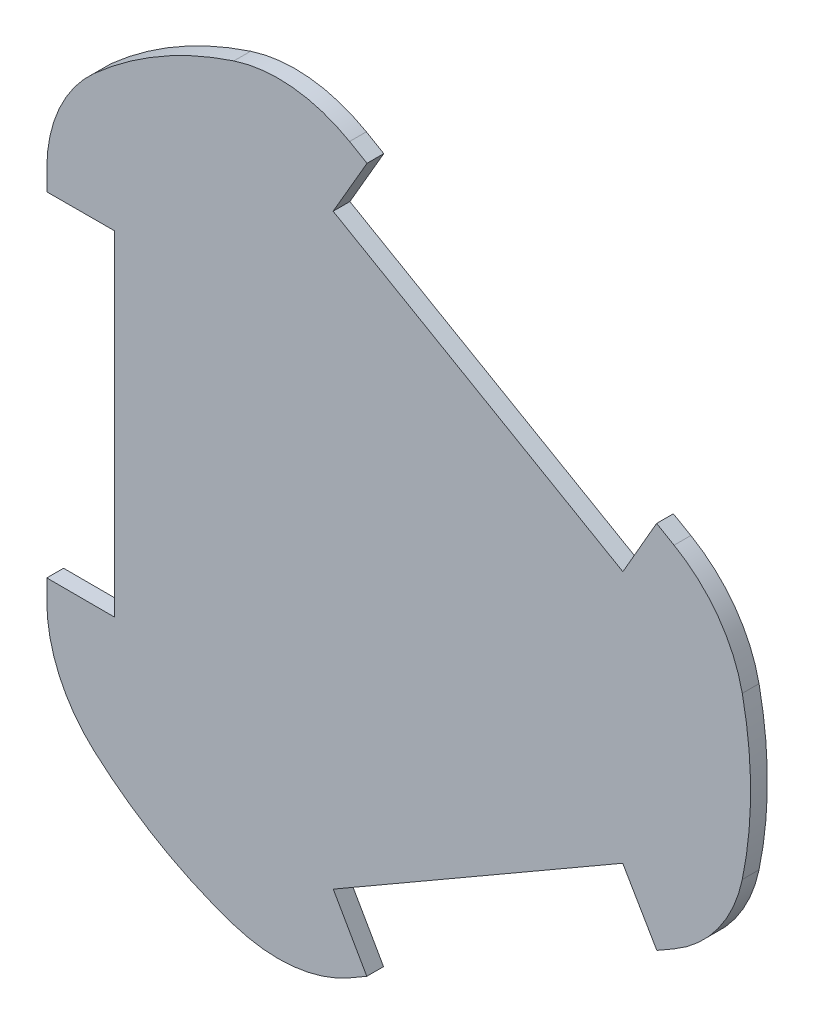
SolidWorks part; units mm, degrees
ref_plane "Front" through (0, 0, 0) normal (0, 0, 1) x (1, 0, 0)
ref_plane "Top" through (0, 0, 0) normal (0, 1, 0) x (1, 0, 0)
ref_plane "Right" through (0, 0, 0) normal (1, 0, 0) x (0, 0, -1)
sketch "Sketch1" plane through (0, 0, 0) normal (0, 0, 1) x (1, 0, 0)
  line L0 (25.6514, 19.1677) -> (-3.7248, 36.1281) construction
  line L1 (-3.7248, 36.1281) -> (0.3266, 43.1127) construction
  line L2 (25.6514, 19.1677) -> (29.6746, 26.1687) construction
  line L3 (0.277, -43.1414) -> (-3.726, -36.1288) construction
  line L4 (-3.726, -36.1288) -> (25.6502, -19.1684) construction
  line L5 (25.6502, -19.1684) -> (29.7218, -26.1414) construction
  line L6 (-45, 16.9447) -> (-36.9254, 16.9611) construction
  line L7 (-36.9254, 16.9611) -> (-36.9254, -16.9597) construction
  line L8 (-36.9254, -16.9597) -> (-45, -16.9434) construction
  line L9 (34.3649, 23.4607) -> (29.6746, 26.1687) construction
  line L10 (29.7218, -26.1414) -> (34.3649, -23.4607) construction
  line L11 (-4.3649, -45.8214) -> (0.277, -43.1414) construction
  line L12 (-45, -16.9434) -> (-45, -22.3607) construction
  line L13 (-45, 22.3607) -> (-45, 16.9447) construction
  line L14 (0.3266, 43.1127) -> (-4.3649, 45.8214) construction
  line L15 (26.7548, 15.0666) -> (-7.8282, 35.033)
  line L16 (-7.8282, 35.033) -> (-3.7767, 42.0177)
  line L17 (-3.7767, 42.0177) -> (-5.8649, 43.2233)
  line L18 (-42, 22.3607) -> (-42, 19.9508)
  line L19 (-42, 19.9508) -> (-33.9254, 19.9671)
  line L20 (-33.9254, 19.9671) -> (-33.9254, -19.9658)
  line L21 (-33.9254, -19.9658) -> (-42, -19.9494)
  line L22 (-42, -19.9494) -> (-42, -22.3607)
  line L23 (-5.8649, -43.2233) -> (-3.8084, -42.0359)
  line L24 (-3.8084, -42.0359) -> (-7.8114, -35.0233)
  line L25 (-7.8114, -35.0233) -> (26.7356, -15.0776)
  line L26 (26.7356, -15.0776) -> (30.8072, -22.0506)
  line L27 (30.8072, -22.0506) -> (32.8649, -20.8626)
  line L28 (32.8649, 20.8626) -> (30.7779, 22.0675)
  line L29 (26.7548, 15.0666) -> (30.7779, 22.0675)
  arc A0 (34.3649, -23.4607) -> (42.366, -14.8557) centre (24.3649, -6.1402) ccw construction
  arc A1 (42.366, -14.8557) -> (43.9415, -10.2336) centre (24.3649, -6.1402) ccw construction
  arc A2 (43.9415, -10.2336) -> (43.9415, 10.2336) centre (-5, 0) ccw construction
  arc A3 (43.9415, 10.2336) -> (42.366, 14.8557) centre (24.3649, 6.1402) ccw construction
  arc A4 (42.366, 14.8557) -> (34.3649, 23.4607) centre (24.3649, 6.1402) ccw construction
  arc A5 (-15.8176, -48.448) -> (-4.3649, -45.8214) centre (-14.3649, -28.5008) ccw construction
  arc A6 (-20.6082, -47.5014) -> (-15.8176, -48.448) centre (-14.3649, -28.5008) ccw construction
  arc A7 (-38.3333, -37.2678) -> (-20.6082, -47.5014) centre (-5, 0) ccw construction
  arc A8 (-41.5484, -33.5923) -> (-38.3333, -37.2678) centre (-25, -22.3607) ccw construction
  arc A9 (-45, -22.3607) -> (-41.5484, -33.5923) centre (-25, -22.3607) ccw construction
  arc A10 (-41.5484, 33.5923) -> (-45, 22.3607) centre (-25, 22.3607) ccw construction
  arc A11 (-38.3333, 37.2678) -> (-41.5484, 33.5923) centre (-25, 22.3607) ccw construction
  arc A12 (-20.6082, 47.5014) -> (-38.3333, 37.2678) centre (-5, 0) ccw construction
  arc A13 (-15.8176, 48.448) -> (-20.6082, 47.5014) centre (-14.3649, 28.5008) ccw construction
  arc A14 (-4.3649, 45.8214) -> (-15.8176, 48.448) centre (-14.3649, 28.5008) ccw construction
  arc A15 (-5.8649, 43.2233) -> (-15.5997, 45.4559) centre (-14.3649, 28.5008) ccw
  arc A16 (-15.5997, 45.4559) -> (-19.6717, 44.6513) centre (-14.3649, 28.5008) ccw
  arc A17 (-19.6717, 44.6513) -> (-36.3333, 35.0317) centre (-5, 0) ccw
  arc A18 (-36.3333, 35.0317) -> (-39.0662, 31.9075) centre (-25, 22.3607) ccw
  arc A19 (-39.0662, 31.9075) -> (-42, 22.3607) centre (-25, 22.3607) ccw
  arc A20 (-42, -22.3607) -> (-39.0662, -31.9075) centre (-25, -22.3607) ccw
  arc A21 (-39.0662, -31.9075) -> (-36.3333, -35.0317) centre (-25, -22.3607) ccw
  arc A22 (-36.3333, -35.0317) -> (-19.6717, -44.6513) centre (-5, 0) ccw
  arc A23 (-19.6717, -44.6513) -> (-15.5997, -45.4559) centre (-14.3649, -28.5008) ccw
  arc A24 (-15.5997, -45.4559) -> (-5.8649, -43.2233) centre (-14.3649, -28.5008) ccw
  arc A25 (32.8649, -20.8626) -> (39.6658, -13.5484) centre (24.3649, -6.1402) ccw
  arc A26 (39.6658, -13.5484) -> (41.005, -9.6196) centre (24.3649, -6.1402) ccw
  arc A27 (41.005, -9.6196) -> (41.005, 9.6196) centre (-5, 0) ccw
  arc A28 (41.005, 9.6196) -> (39.6658, 13.5484) centre (24.3649, 6.1402) ccw
  arc A29 (39.6658, 13.5484) -> (32.8649, 20.8626) centre (24.3649, 6.1402) ccw
  circle A30 centre (-25, 34.641) radius 5
  circle A31 centre (35, 0) radius 5
  circle A32 centre (-25, -34.641) radius 5
  dimension "D1" = 10
  dimension "D2" = 10
  dimension "D3" = 10
extrude "Boss-Extrude1" add sketch "Sketch1" along normal blind 2
sketch "Sketch2" plane through (0, 0, 2) normal (0, 0, 1) x (1, 0, 0)
  circle A0 centre (-25, 34.641) radius 6
  circle A1 centre (-25, -34.641) radius 6
  circle A2 centre (35, 0) radius 6
extrude "Boss-Extrude2" add sketch "Sketch2" against normal blind 2
sketch "Sketch4" plane through (0, 0, 0) normal (0, 0, -1) x (-1, 0, 0)
  circle A0 centre (25, 34.641) radius 4
  circle A1 centre (-35, 0) radius 4
  circle A2 centre (25, -34.641) radius 4
  dimension "D1" = 8
extrude "Boss-Extrude3" add sketch "Sketch4" along normal blind 1
